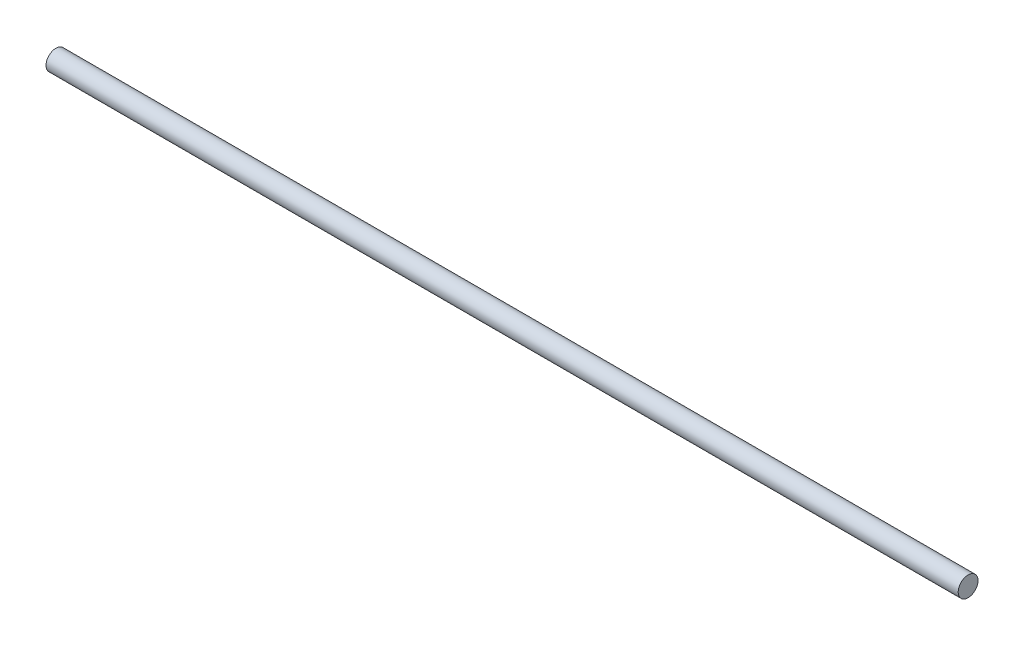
SolidWorks part; units mm, degrees
ref_plane "Front Plane" through (0, 0, 0) normal (1, 0, 0) x (0, 1, 0)
ref_plane "Top Plane" through (0, 0, 0) normal (0, 0, 1) x (0, 1, 0)
ref_plane "Right Plane" through (0, 0, 0) normal (0, 1, 0) x (-1, 0, 0)
sketch "Sketch1" plane through (0, 0, 0) normal (1, 0, 0) x (0, 1, 0)
  circle A0 centre (0, 0) radius 28.6639
  dimension "D1" = 57.3278
extrude "N18 - 2.257in - 8.7ft" add sketch "Sketch1" along normal mid plane 2636.45
ref_plane "6.9in offset 1" through (1143.35, 0, 0) normal (1, 0, 0) x (0, 1, 0)
ref_plane "6.9in offset 2" through (-1143.35, 0, 0) normal (-1, 0, 0) x (0, -1, 0)
